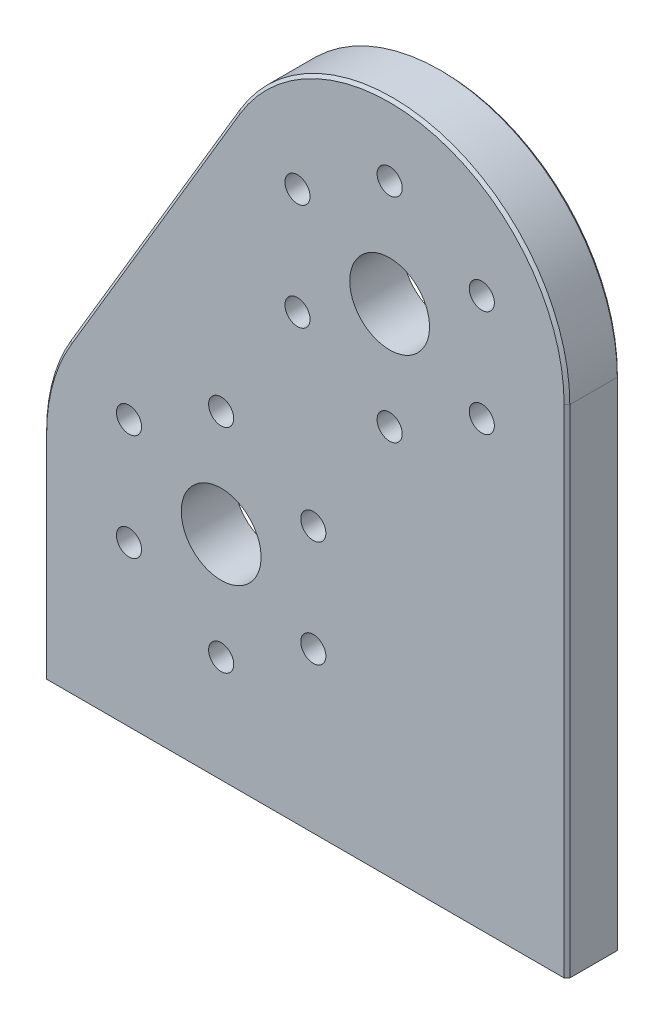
SolidWorks part; units mm, degrees
ref_plane "Front Plane" through (0, 0, 0) normal (0, 0, 1) x (1, 0, 0)
ref_plane "Top Plane" through (0, 0, 0) normal (0, 1, 0) x (1, 0, 0)
ref_plane "Right Plane" through (0, 0, 0) normal (1, 0, 0) x (0, 0, -1)
sketch "Sketch1" plane through (0, 0, 0) normal (0, 0, 1) x (1, 0, 0)
  line L0 (-27.3004, 54.3096) -> (2.8621, 105.1096)
  line L2 (-31.75, 38.1) -> (-31.75, 0)
  line L3 (-31.75, 0) -> (61.9125, 0)
  line L4 (61.9125, 88.9) -> (61.9125, 0)
  line L6 (0, 0) -> (0, 112.872) construction
  line L7 (30.1625, 88.9) -> (30.1625, 106.3892) construction
  circle A0 centre (0, 38.1) radius 7.1438
  circle A1 centre (30.1625, 88.9) radius 7.1438
  arc A2 (61.9125, 88.9) -> (2.8621, 105.1096) centre (30.1625, 88.9) ccw
  arc A3 (-27.3004, 54.3096) -> (-31.75, 38.1) centre (0, 38.1) ccw
  dimension "D1" = 14.2875
  dimension "D2" = 14.2875
  dimension "D6" = 30.1625
  dimension "D5" = 63.5
  dimension "D7" = 63.5
  dimension "D3" = 38.1
  dimension "D4" = 50.8
extrude "Extrude1" add sketch "Sketch1" along normal mid plane 9.525
hole_wizard "#8-32 Tapped Hole1" positions "Sketch3" profile "Sketch2" tap size "#8-32" standard "Ansi Inch"
sketch "Sketch3" plane through (0, 0, 0) normal (0, -1, 0) x (1, 0, 0)
  line L0 (0, 0) -> (0, 14.985) construction
  point P0 (25.4, 0)
  point P1 (-25.4, 0)
  dimension "D1" = 50.8
sketch "Sketch2" plane through (25.4, 0, 0) normal (1, 0, 0) x (0, 0, -1)
  line L0 (0, 0) -> (0, 21.2054)
  line L1 (0, 21.2054) -> (1.7272, 20.1676)
  line L2 (1.7272, 20.1676) -> (1.7272, 17.78)
  line L3 (1.7272, 17.78) -> (2.0828, 17.78)
  line L4 (2.0828, 17.78) -> (2.0828, 0)
  line L5 (2.0828, 0) -> (0, 0)
  line L10 (0, 21.2054) -> (-1.7272, 20.1676) construction
  line L11 (0, -6.35) -> (0, 107.95) construction
  dimension "Tap Drill Dia." = 3.4544
  dimension "Tap Drill Depth" = 20.1676
  dimension "Thread Major Dia." = 4.1656
  dimension "Thread Depth" = 17.78
  dimension "Drill Angle" = 118
hole_wizard "#8 Clearance Hole1" positions "Sketch5" profile "Sketch4" hole size "#8" standard "Ansi Inch"
sketch "Sketch5" plane through (0, 0, 4.7625) normal (0, 0, 1) x (1, 0, 0)
  line L0 (30.1625, 88.9) -> (49.2125, 88.9) construction
  line L1 (30.1625, 88.9) -> (46.6603, 98.425) construction
  line L2 (0, 38.1) -> (19.05, 38.1) construction
  line L3 (0, 38.1) -> (16.4978, 47.625) construction
  line L4 (0, 38.1) -> (0, 57.15) construction
  line L5 (30.1625, 88.9) -> (30.1625, 107.95) construction
  circle A0 centre (30.1625, 88.9) radius 19.05 construction
  circle A1 centre (0, 38.1) radius 19.05 construction
  arc A3 (-27.3004, 54.3096) -> (-31.75, 38.1) centre (0, 38.1) ccw construction
  arc A4 (61.9125, 88.9) -> (2.8621, 105.1096) centre (30.1625, 88.9) ccw construction
  point P0 (30.1625, 69.85)
  point P1 (13.6647, 79.375)
  point P3 (46.6603, 98.425)
  point P5 (30.1625, 107.95)
  point P7 (13.6647, 98.425)
  point P9 (46.6603, 79.375)
  point P11 (16.4978, 47.625)
  point P13 (16.4978, 28.575)
  point P15 (0, 57.15)
  point P17 (-16.4978, 28.575)
  point P19 (-16.4978, 47.625)
  point P21 (0, 19.05)
  dimension "D1" = 38.1
  dimension "D2" = 30
  dimension "D3" = 30
sketch "Sketch4" plane through (30.1625, 69.85, 4.7625) normal (1, 0, 0) x (0, -1, 0)
  line L0 (0, 0) -> (0, 9.525)
  line L1 (0, 9.525) -> (2.2479, 9.525)
  line L2 (2.2479, 9.525) -> (2.2479, 0)
  line L5 (2.2479, 0) -> (0, 0)
  line L11 (0, -6.35) -> (0, 107.95) construction
  dimension "Thru Hole Dia." = 4.4958
  dimension "Thru Hole Depth" = 9.525
sketch "Sketch6" plane through (0, 0, 0) normal (0, -1, 0) x (1, 0, 0)
  circle A0 centre (0, 0) radius 2.3813
  circle A1 centre (50.8, 0) radius 2.3812
  circle A4 centre (-25.4, 0) radius 2.0828 construction
  circle A5 centre (25.4, 0) radius 2.0828 construction
  dimension "D1" = 25.4
  dimension "D2" = 25.4
  dimension "D3" = 4.7625
extrude "Cut-Extrude1" cut sketch "Sketch6" against normal blind 12.7
chamfer "Chamfer1" distance 0.508 angle 45 10 edges at (-31.75, 19.05, 4.7625) (-30.6174, 46.5046, 4.7625) (-12.2191, 79.7096, 4.7625) (38.5671, 119.5174, 4.7625) (61.9125, 44.45, 4.7625) (-31.75, 19.05, -4.7625) (-30.6174, 46.5046, -4.7625) (-12.2191, 79.7096, -4.7625) (38.5671, 119.5174, -4.7625) (61.9125, 44.45, -4.7625)
